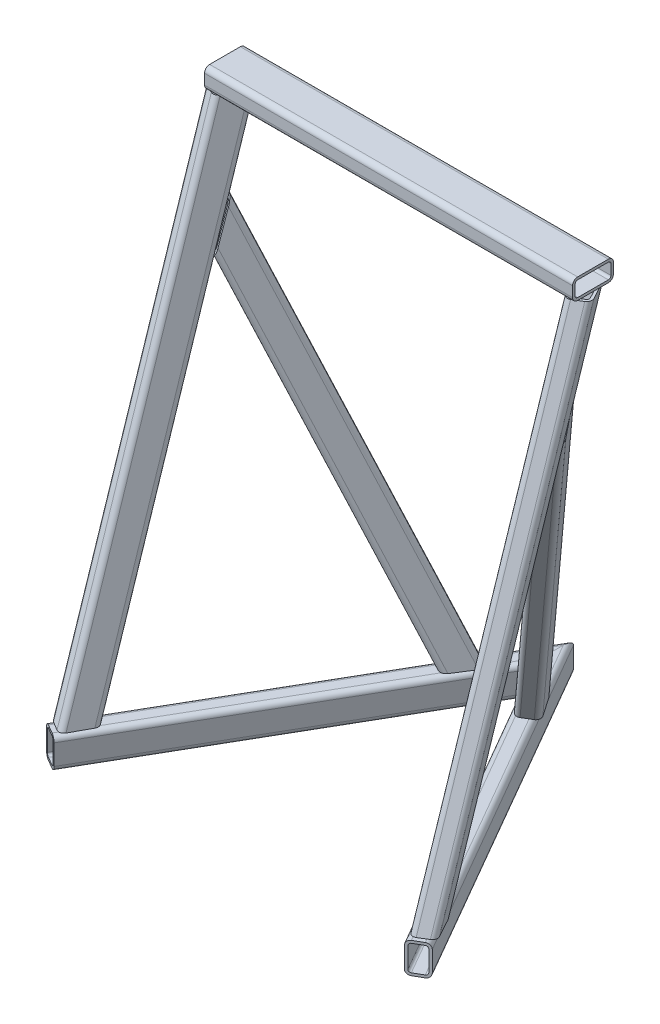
SolidWorks part; units mm, degrees
ref_plane "Front Plane" through (0, 0, 0) normal (0, 0, 1) x (1, 0, 0)
ref_plane "Top Plane" through (0, 0, 0) normal (0, 1, 0) x (1, 0, 0)
ref_plane "Right Plane" through (0, 0, 0) normal (1, 0, 0) x (0, 0, -1)
sketch "Sketch1" plane through (0, 0, 0) normal (0, 1, 0) x (1, 0, 0)
  line L0 (0, 0) -> (-457.2, -791.8936)
  line L1 (0, 0) -> (457.2, -791.8936)
  line L2 (-457.2, -791.8936) -> (457.2, -791.8936)
  dimension "D1" = 914.4
ref_plane "Plane1" through (0, 1219.2, 0) normal (0, 1, 0) x (-1, 0, 0)
sketch "Sketch2" plane through (0, 1219.2, 0) normal (0, 1, 0) x (-1, 0, 0)
  line L0 (0, 791.8936) -> (0, 0) construction
  line L1 (457.2, 791.8936) -> (-457.2, 791.8936) construction
  line L2 (457.2, 395.9468) -> (-457.2, 395.9468) construction
  point P7 (0, 395.9468)
  dimension "D1" = 914.4
sketch3d "3DSketch1"
  line L0 (-457.2, 1219.2, 395.9468) -> (-457.2, 0, 791.8936)
  line L1 (457.2, 1219.2, 395.9468) -> (457.2, 0, 791.8936)
  line L2 (457.2, 1219.2, 395.9468) -> (-457.2, 1219.2, 395.9468)
  line L3 (-457.2, 1074.2522, 443.02) -> (-76.2, 0, 131.9823)
  line L4 (0, 0, 0) -> (-457.2, 0, 791.8936) construction
  line L5 (457.2, 1074.2522, 443.02) -> (76.2, 0, 131.9823)
  line L6 (0, 0, 0) -> (457.2, 0, 791.8936) construction
  dimension "D1" = 152.4
  dimension "D2" = 152.4
  dimension "D3" = 152.4
  dimension "D4" = 152.4
other "Structural Member1"
ref_plane "Plane2" through (0, 0, 0) normal (-0.5, 0, 0.866) x (0.866, 0, 0.5)
sketch "Sketch11" plane through (0, 0, 0) normal (-0.5, 0, 0.866) x (0.866, 0, 0.5)
  line L0 (-12.7, -31.75) -> (12.7, -31.75)
  line L1 (-19.05, -25.4) -> (-19.05, 25.4)
  line L2 (12.7, 31.75) -> (-12.7, 31.75)
  line L3 (19.05, 25.4) -> (19.05, -25.4)
  line L4 (-12.7, -38.1) -> (12.7, -38.1)
  line L5 (-25.4, -25.4) -> (-25.4, 25.4)
  line L6 (12.7, 38.1) -> (-12.7, 38.1)
  line L7 (25.4, 25.4) -> (25.4, -25.4)
  line L8 (0, 0) -> (25.4, 0) construction
  line L9 (0, 0) -> (0, 38.1) construction
  arc A0 (25.4, 25.4) -> (12.7, 38.1) centre (12.7, 25.4) ccw
  arc A1 (12.7, -38.1) -> (25.4, -25.4) centre (12.7, -25.4) ccw
  arc A2 (-25.4, -25.4) -> (-12.7, -38.1) centre (-12.7, -25.4) ccw
  arc A3 (-12.7, 38.1) -> (-25.4, 25.4) centre (-12.7, 25.4) ccw
  arc A4 (-12.7, 31.75) -> (-19.05, 25.4) centre (-12.7, 25.4) ccw
  arc A5 (19.05, 25.4) -> (12.7, 31.75) centre (12.7, 25.4) ccw
  arc A6 (12.7, -31.75) -> (19.05, -25.4) centre (12.7, -25.4) ccw
  arc A7 (-19.05, -25.4) -> (-12.7, -31.75) centre (-12.7, -25.4) ccw
  point P3 (0, -38.1)
  point P4 (-25.4, 0)
  point P5 (0, 0)
  point P6 (25.4, -38.1)
  point P7 (-25.4, -38.1)
  point P8 (-25.4, 38.1)
  point P33 (0, 0)
  point P35 (25.4, 38.1)
  point P36 (25.4, 0)
  point P37 (0, 38.1)
  dimension "D1" = 12.7
  dimension "Thickness" = 6.35
  dimension "V_leg" = 76.2
  dimension "H_leg" = 50.8
other "Structural Member2"
ref_plane "Plane3" through (-457.2, 1219.2, 395.9468) normal (0, -0.9511, 0.3089) x (1, 0, 0)
sketch "Sketch12" plane through (-438.15, 1209.0084, 364.5647) normal (0, -0.9511, 0.3089) x (-0.866, -0.1544, -0.4756)
  line L0 (-12.7, -31.75) -> (12.7, -31.75)
  line L1 (-19.05, -25.4) -> (-19.05, 25.4)
  line L2 (12.7, 31.75) -> (-12.7, 31.75)
  line L3 (19.05, 25.4) -> (19.05, -25.4)
  line L4 (-12.7, -38.1) -> (12.7, -38.1)
  line L5 (-25.4, -25.4) -> (-25.4, 25.4)
  line L6 (12.7, 38.1) -> (-12.7, 38.1)
  line L7 (25.4, 25.4) -> (25.4, -25.4)
  line L8 (0, 0) -> (25.4, 0) construction
  line L9 (0, 0) -> (0, 38.1) construction
  arc A0 (25.4, 25.4) -> (12.7, 38.1) centre (12.7, 25.4) ccw
  arc A1 (12.7, -38.1) -> (25.4, -25.4) centre (12.7, -25.4) ccw
  arc A2 (-25.4, -25.4) -> (-12.7, -38.1) centre (-12.7, -25.4) ccw
  arc A3 (-12.7, 38.1) -> (-25.4, 25.4) centre (-12.7, 25.4) ccw
  arc A4 (-12.7, 31.75) -> (-19.05, 25.4) centre (-12.7, 25.4) ccw
  arc A5 (19.05, 25.4) -> (12.7, 31.75) centre (12.7, 25.4) ccw
  arc A6 (12.7, -31.75) -> (19.05, -25.4) centre (12.7, -25.4) ccw
  arc A7 (-19.05, -25.4) -> (-12.7, -31.75) centre (-12.7, -25.4) ccw
  point P3 (0, -38.1)
  point P4 (-25.4, 0)
  point P5 (0, 0)
  point P6 (25.4, -38.1)
  point P7 (-25.4, -38.1)
  point P8 (-25.4, 38.1)
  point P33 (0, 0)
  point P35 (25.4, 38.1)
  point P36 (25.4, 0)
  point P37 (0, 38.1)
  dimension "D1" = 12.7
  dimension "Thickness" = 6.35
  dimension "V_leg" = 76.2
  dimension "H_leg" = 50.8
other "Structural Member3"
ref_plane "Plane5" through (457.2, 1219.2, 395.9468) normal (0, -0.9511, 0.3089) x (1, 0, 0)
sketch "Sketch14" plane through (438.15, 1209.0084, 364.5647) normal (0, -0.9511, 0.3089) x (0.866, -0.1544, -0.4756)
  line L0 (-12.7, -31.75) -> (12.7, -31.75)
  line L1 (-19.05, -25.4) -> (-19.05, 25.4)
  line L2 (12.7, 31.75) -> (-12.7, 31.75)
  line L3 (19.05, 25.4) -> (19.05, -25.4)
  line L4 (-12.7, -38.1) -> (12.7, -38.1)
  line L5 (-25.4, -25.4) -> (-25.4, 25.4)
  line L6 (12.7, 38.1) -> (-12.7, 38.1)
  line L7 (25.4, 25.4) -> (25.4, -25.4)
  line L8 (0, 0) -> (25.4, 0) construction
  line L9 (0, 0) -> (0, 38.1) construction
  arc A0 (25.4, 25.4) -> (12.7, 38.1) centre (12.7, 25.4) ccw
  arc A1 (12.7, -38.1) -> (25.4, -25.4) centre (12.7, -25.4) ccw
  arc A2 (-25.4, -25.4) -> (-12.7, -38.1) centre (-12.7, -25.4) ccw
  arc A3 (-12.7, 38.1) -> (-25.4, 25.4) centre (-12.7, 25.4) ccw
  arc A4 (-12.7, 31.75) -> (-19.05, 25.4) centre (-12.7, 25.4) ccw
  arc A5 (19.05, 25.4) -> (12.7, 31.75) centre (12.7, 25.4) ccw
  arc A6 (12.7, -31.75) -> (19.05, -25.4) centre (12.7, -25.4) ccw
  arc A7 (-19.05, -25.4) -> (-12.7, -31.75) centre (-12.7, -25.4) ccw
  point P3 (0, -38.1)
  point P4 (-25.4, 0)
  point P5 (0, 0)
  point P6 (25.4, -38.1)
  point P7 (-25.4, -38.1)
  point P8 (-25.4, 38.1)
  point P33 (0, 0)
  point P35 (25.4, 38.1)
  point P36 (25.4, 0)
  point P37 (0, 38.1)
  dimension "D1" = 12.7
  dimension "Thickness" = 6.35
  dimension "V_leg" = 76.2
  dimension "H_leg" = 50.8
other "Trim/Extend4"
other "Structural Member4"
ref_plane "Plane6" through (457.2, 1219.2, 395.9468) normal (-1, 0, 0) x (0, 0, 1)
sketch "Sketch16" plane through (457.2, 1244.6, 357.8468) normal (-1, 0, 0) x (0, -1, 0)
  line L0 (-12.7, -44.45) -> (12.7, -44.45)
  line L1 (-19.05, -38.1) -> (-19.05, 38.1)
  line L2 (12.7, 44.45) -> (-12.7, 44.45)
  line L3 (19.05, 38.1) -> (19.05, -38.1)
  line L4 (-12.7, -50.8) -> (12.7, -50.8)
  line L5 (-25.4, -38.1) -> (-25.4, 38.1)
  line L6 (12.7, 50.8) -> (-12.7, 50.8)
  line L7 (25.4, 38.1) -> (25.4, -38.1)
  line L8 (0, 0) -> (25.4, 0) construction
  line L9 (0, 0) -> (0, 50.8) construction
  arc A0 (25.4, 38.1) -> (12.7, 50.8) centre (12.7, 38.1) ccw
  arc A1 (12.7, -50.8) -> (25.4, -38.1) centre (12.7, -38.1) ccw
  arc A2 (-25.4, -38.1) -> (-12.7, -50.8) centre (-12.7, -38.1) ccw
  arc A3 (-12.7, 50.8) -> (-25.4, 38.1) centre (-12.7, 38.1) ccw
  arc A4 (-12.7, 44.45) -> (-19.05, 38.1) centre (-12.7, 38.1) ccw
  arc A5 (19.05, 38.1) -> (12.7, 44.45) centre (12.7, 38.1) ccw
  arc A6 (12.7, -44.45) -> (19.05, -38.1) centre (12.7, -38.1) ccw
  arc A7 (-19.05, -38.1) -> (-12.7, -44.45) centre (-12.7, -38.1) ccw
  point P3 (0, -50.8)
  point P4 (-25.4, 0)
  point P5 (0, 0)
  point P6 (25.4, -50.8)
  point P7 (-25.4, -50.8)
  point P8 (-25.4, 50.8)
  point P33 (0, 0)
  point P35 (25.4, 50.8)
  point P36 (25.4, 0)
  point P37 (0, 50.8)
  dimension "D1" = 12.7
  dimension "Thickness" = 6.35
  dimension "V_leg" = 101.6
  dimension "H_leg" = 50.8
other "Trim/Extend5"
other "Structural Member5"
ref_plane "Plane7" through (-457.2, 1074.2522, 443.02) normal (0.3225, -0.9092, -0.2633) x (0.9462, 0.3177, 0.0617)
sketch "Sketch17" plane through (-457.2, 1074.2522, 443.02) normal (0.3225, -0.9092, -0.2633) x (-0.8332, -0.1407, -0.5348)
  line L0 (-12.7, -31.75) -> (12.7, -31.75)
  line L1 (-19.05, -25.4) -> (-19.05, 25.4)
  line L2 (12.7, 31.75) -> (-12.7, 31.75)
  line L3 (19.05, 25.4) -> (19.05, -25.4)
  line L4 (-12.7, -38.1) -> (12.7, -38.1)
  line L5 (-25.4, -25.4) -> (-25.4, 25.4)
  line L6 (12.7, 38.1) -> (-12.7, 38.1)
  line L7 (25.4, 25.4) -> (25.4, -25.4)
  line L8 (0, 0) -> (25.4, 0) construction
  line L9 (0, 0) -> (0, 38.1) construction
  arc A0 (25.4, 25.4) -> (12.7, 38.1) centre (12.7, 25.4) ccw
  arc A1 (12.7, -38.1) -> (25.4, -25.4) centre (12.7, -25.4) ccw
  arc A2 (-25.4, -25.4) -> (-12.7, -38.1) centre (-12.7, -25.4) ccw
  arc A3 (-12.7, 38.1) -> (-25.4, 25.4) centre (-12.7, 25.4) ccw
  arc A4 (-12.7, 31.75) -> (-19.05, 25.4) centre (-12.7, 25.4) ccw
  arc A5 (19.05, 25.4) -> (12.7, 31.75) centre (12.7, 25.4) ccw
  arc A6 (12.7, -31.75) -> (19.05, -25.4) centre (12.7, -25.4) ccw
  arc A7 (-19.05, -25.4) -> (-12.7, -31.75) centre (-12.7, -25.4) ccw
  point P3 (0, -38.1)
  point P4 (-25.4, 0)
  point P5 (0, 0)
  point P6 (25.4, -38.1)
  point P7 (-25.4, -38.1)
  point P8 (-25.4, 38.1)
  point P33 (0, 0)
  point P35 (25.4, 38.1)
  point P36 (25.4, 0)
  point P37 (0, 38.1)
  dimension "D1" = 12.7
  dimension "Thickness" = 6.35
  dimension "V_leg" = 76.2
  dimension "H_leg" = 50.8
other "Trim/Extend6"
other "Structural Member6"
ref_plane "Plane8" through (457.2, 1074.2522, 443.02) normal (-0.3225, -0.9092, -0.2633) x (0.9466, -0.3098, -0.0897)
sketch "Sketch18" plane through (457.2, 1074.2522, 443.02) normal (-0.3225, -0.9092, -0.2633) x (0.8198, -0.1292, -0.5579)
  line L0 (-12.7, -31.75) -> (12.7, -31.75)
  line L1 (-19.05, -25.4) -> (-19.05, 25.4)
  line L2 (12.7, 31.75) -> (-12.7, 31.75)
  line L3 (19.05, 25.4) -> (19.05, -25.4)
  line L4 (-12.7, -38.1) -> (12.7, -38.1)
  line L5 (-25.4, -25.4) -> (-25.4, 25.4)
  line L6 (12.7, 38.1) -> (-12.7, 38.1)
  line L7 (25.4, 25.4) -> (25.4, -25.4)
  line L8 (0, 0) -> (25.4, 0) construction
  line L9 (0, 0) -> (0, 38.1) construction
  arc A0 (25.4, 25.4) -> (12.7, 38.1) centre (12.7, 25.4) ccw
  arc A1 (12.7, -38.1) -> (25.4, -25.4) centre (12.7, -25.4) ccw
  arc A2 (-25.4, -25.4) -> (-12.7, -38.1) centre (-12.7, -25.4) ccw
  arc A3 (-12.7, 38.1) -> (-25.4, 25.4) centre (-12.7, 25.4) ccw
  arc A4 (-12.7, 31.75) -> (-19.05, 25.4) centre (-12.7, 25.4) ccw
  arc A5 (19.05, 25.4) -> (12.7, 31.75) centre (12.7, 25.4) ccw
  arc A6 (12.7, -31.75) -> (19.05, -25.4) centre (12.7, -25.4) ccw
  arc A7 (-19.05, -25.4) -> (-12.7, -31.75) centre (-12.7, -25.4) ccw
  point P3 (0, -38.1)
  point P4 (-25.4, 0)
  point P5 (0, 0)
  point P6 (25.4, -38.1)
  point P7 (-25.4, -38.1)
  point P8 (-25.4, 38.1)
  point P33 (0, 0)
  point P35 (25.4, 38.1)
  point P36 (25.4, 0)
  point P37 (0, 38.1)
  dimension "D1" = 12.7
  dimension "Thickness" = 6.35
  dimension "V_leg" = 76.2
  dimension "H_leg" = 50.8
other "Trim/Extend7"
